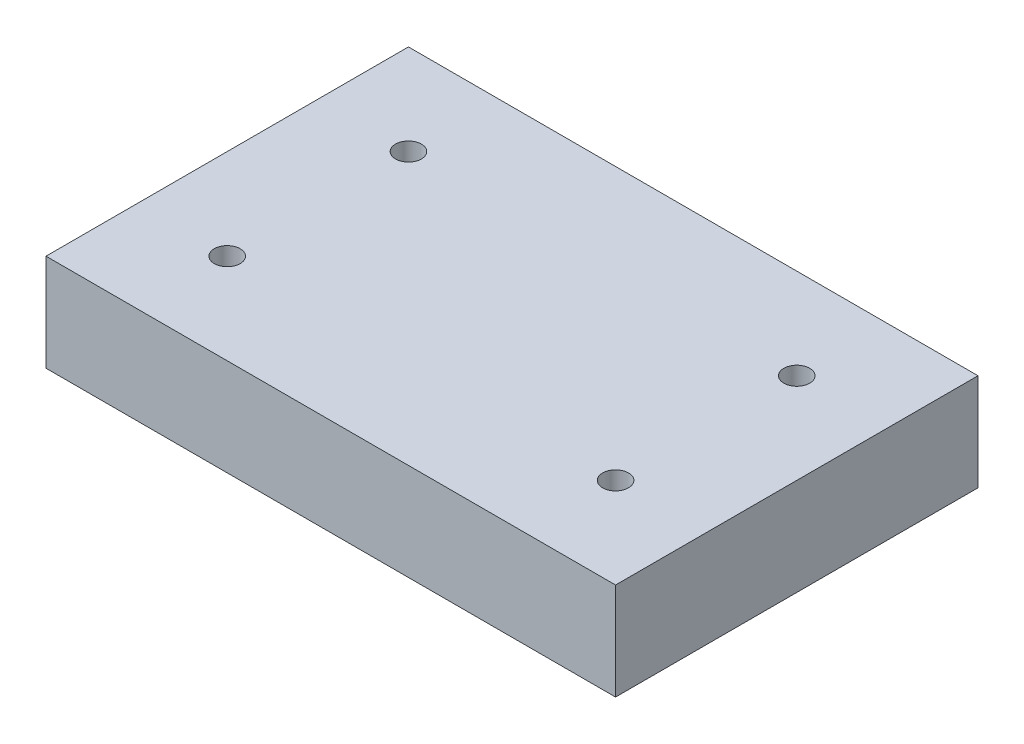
SolidWorks part; units mm, degrees
ref_plane "Front Plane" through (0, 0, 0) normal (0, 0, 1) x (1, 0, 0)
ref_plane "Top Plane" through (0, 0, 0) normal (0, 1, 0) x (1, 0, 0)
ref_plane "Right Plane" through (0, 0, 0) normal (1, 0, 0) x (0, 0, -1)
sketch "Sketch1" plane through (0, 0, 0) normal (0, 1, 0) x (1, 0, 0)
  line L5 (0, 88.9) -> (139.7, 88.9)
  line L6 (0, 88.9) -> (0, 0)
  line L7 (0, 0) -> (139.7, 0)
  line L8 (139.7, 88.9) -> (139.7, 0)
  point P10 (69.85, 0)
  point P12 (0, 44.45)
  dimension "D3" = 139.7
  dimension "D4" = 88.9
extrude "Boss-Extrude1" add sketch "Sketch1" along normal blind 23.8125
hole_wizard "1/4 (0.25) Diameter Hole1" positions "Sketch2" profile "Sketch3" hole size "1/4" standard "ANSI Inch"
sketch "Sketch2" plane through (0, 23.8125, 0) normal (0, 1, 0) x (1, 0, 0)
  line L0 (0, 0) -> (139.7, 0) construction
  line L1 (139.7, 0) -> (139.7, 88.9) construction
  point P0 (22.225, 66.675)
  point P2 (117.475, 66.675)
  point P4 (117.475, 22.225)
  point P6 (22.225, 22.225)
  point P11 (69.85, 0)
  point P14 (139.7, 44.45)
  point P15 (0, 0)
  point P16 (0, 0)
  point P17 (0, 0)
  point P18 (0, 0)
  dimension "D1" = 44.45
  dimension "D2" = 95.25
  dimension "D3" = 47.625
  dimension "D4" = 22.225
sketch "Sketch3" plane through (22.225, 23.8125, -66.675) normal (1, 0, 0) x (0, 0, 1)
  line L0 (0, 0) -> (0, 23.8125)
  line L1 (0, 23.8125) -> (3.175, 23.8125)
  line L2 (3.175, 23.8125) -> (3.175, 0)
  line L5 (3.175, 0) -> (0, 0)
  line L11 (0, -6.35) -> (0, 107.95) construction
  dimension "Thru Hole Dia." = 6.35
  dimension "Thru Hole Depth" = 23.8125
